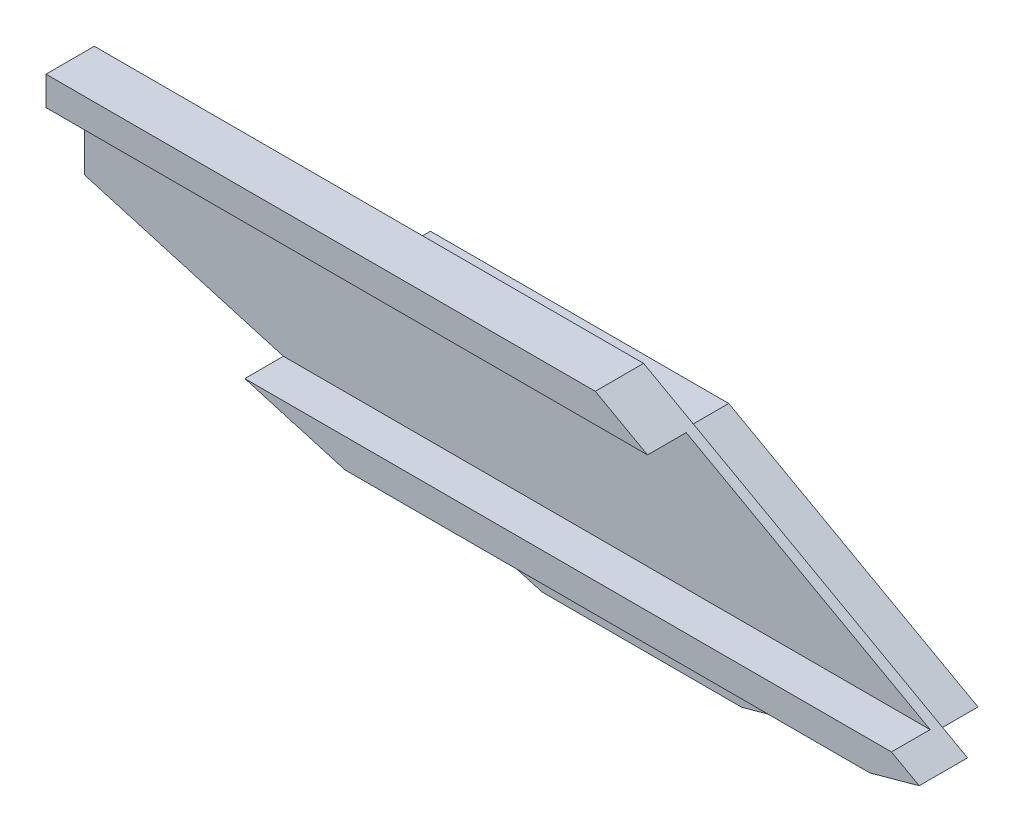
SolidWorks part; units mm, degrees
ref_plane "前视基准面" through (0, 0, 0) normal (0, 0, 1) x (1, 0, 0)
ref_plane "上视基准面" through (0, 0, 0) normal (0, 1, 0) x (1, 0, 0)
ref_plane "右视基准面" through (0, 0, 0) normal (1, 0, 0) x (0, 0, -1)
sketch "草图1" plane through (0, 0, 0) normal (0, 0, 1) x (1, 0, 0)
  line L1 (0, 0) -> (33, 0)
  line L2 (0, 0) -> (0, -10)
  line L3 (0, -10) -> (33, -10)
  line L4 (33, 0) -> (33, -10)
  dimension "D1" = 10
  dimension "D2" = 33
extrude "凸台-拉伸1" add sketch "草图1" along normal blind 0.5
sketch "草图2" plane through (0, 0, 0.5) normal (0, 0, 1) x (1, 0, 0)
  line L0 (-0.5, 0.5) -> (-0.5, -10.5)
  line L1 (-0.5, -10.5) -> (33.5, -10.5)
  line L2 (33.5, -10.5) -> (33.5, 0.5)
  line L3 (33.5, 0.5) -> (-0.5, 0.5)
  line L4 (0, 0) -> (0, -10)
  line L5 (0, -10) -> (33, -10)
  line L6 (33, -10) -> (33, 0)
  line L7 (33, 0) -> (0, 0)
  line L8 (0, 0) -> (0, -10)
  line L9 (0, -10) -> (33, -10)
  line L10 (33, -10) -> (33, 0)
  line L11 (33, 0) -> (0, 0)
  dimension "D1" = 0
  dimension "D2" = 0.5
extrude "凸台-拉伸2" add sketch "草图2" along normal blind 1 separate body
sketch "草图3" plane through (0, 0, 0.5) normal (0, 0, -1) x (-1, 0, 0)
  line L4 (0.5, 0.5) -> (-33.5, 0.5)
  line L5 (-33.5, 0.5) -> (-33.5, -10.5)
  line L6 (-33.5, -10.5) -> (0.5, -10.5)
  line L7 (0.5, -10.5) -> (0.5, 0.5)
  line L8 (0.5, 0.5) -> (-33.5, 0.5)
  line L9 (-33.5, 0.5) -> (-33.5, -10.5)
  line L10 (-33.5, -10.5) -> (0.5, -10.5)
  line L11 (0.5, -10.5) -> (0.5, 0.5)
  dimension "D1" = 0
extrude "凸台-拉伸3" add sketch "草图3" along normal up to vertex (0.5 mm away)
sketch "草图5" plane through (0, 0, 0) normal (0, 0, -1) x (-1, 0, 0)
  line L0 (-30.4036, 0.5) -> (-44.6915, -7.423)
  line L1 (-34.1336, -10.3686) -> (-29.3262, -8.9763)
  line L2 (-34.1336, -10.3686) -> (-29.3262, -8.9763)
  line L3 (-24.5283, -7.5868) -> (-19.7209, -6.1945)
  line L4 (-14.923, -4.805) -> (-10.1156, -3.4128)
  line L7 (-47.4457, -13.1749) -> (14.8709, 3.8235)
  line L8 (14.8709, 3.8235) -> (-26.6643, 2.5735)
  line L9 (-26.6643, 2.5735) -> (-30.4036, 0.5)
  line L10 (-30.4036, 0.5) -> (-13.3052, 0.5)
  line L11 (-13.3052, 0.5) -> (-44.6915, -7.423)
  line L12 (-44.6915, -7.423) -> (-53.6377, -12.3838)
  line L13 (-53.6377, -12.3838) -> (-47.4457, -13.1749)
  line L17 (-30.4036, 0.5) -> (-13.3052, 0.5)
  line L18 (-13.3052, 0.5) -> (-44.6915, -7.423)
  line L38 (-14.923, -4.805) -> (-19.7209, -6.1945)
  line L39 (-19.7209, -6.1945) -> (-14.6037, -6.1945)
  line L40 (-14.6037, -6.1945) -> (-19.411, -7.5868)
  line L41 (-19.411, -7.5868) -> (-24.5283, -7.5868)
  line L42 (-24.5283, -7.5868) -> (-29.3262, -8.9763)
  line L43 (-29.3262, -8.9763) -> (-24.209, -8.9763)
  line L44 (-24.209, -8.9763) -> (-29.0163, -10.3686)
  line L45 (-29.0163, -10.3686) -> (-34.1336, -10.3686)
  line L46 (-34.1336, -10.3686) -> (-40.3969, -12.1825)
  line L47 (-40.3969, -12.1825) -> (-30.038, -15.1825)
  line L48 (-30.038, -15.1825) -> (-20.1276, -15.1825)
  line L49 (-20.1276, -15.1825) -> (-8.8461, -9.538)
  line L50 (-8.8461, -9.538) -> (-8.8449, -9.5434)
  line L51 (-8.8449, -9.5434) -> (3.0947, -9.5434)
  line L52 (3.0947, -9.5434) -> (23.0511, -0.8309)
  line L53 (23.0511, -0.8309) -> (9.6613, -0.8992)
  line L54 (9.6613, -0.8992) -> (9.6881, -0.8685)
  line L55 (9.6881, -0.8685) -> (8.4073, -0.9056)
  line L56 (8.4073, -0.9056) -> (17.8593, 3.8235)
  line L57 (17.8593, 3.8235) -> (14.8709, 3.8235)
  line L58 (14.8709, 3.8235) -> (-10.1156, -3.4128)
  line L59 (-10.1156, -3.4128) -> (-4.9984, -3.4128)
  line L60 (-4.9984, -3.4128) -> (-9.8057, -4.805)
  line L61 (-9.8057, -4.805) -> (-14.923, -4.805)
  line L63 (-19.7209, -6.1945) -> (-14.6037, -6.1945)
  line L64 (-14.6037, -6.1945) -> (-19.411, -7.5868)
  line L65 (-19.411, -7.5868) -> (-24.5283, -7.5868)
  line L67 (-29.3262, -8.9763) -> (-24.209, -8.9763)
  line L68 (-24.209, -8.9763) -> (-29.0163, -10.3686)
  line L69 (-29.0163, -10.3686) -> (-34.1336, -10.3686)
  line L74 (-8.8461, -9.538) -> (-8.8449, -9.5434)
  line L83 (-10.1156, -3.4128) -> (-4.9984, -3.4128)
  line L84 (-4.9984, -3.4128) -> (-9.8057, -4.805)
  line L85 (-9.8057, -4.805) -> (-14.923, -4.805)
  dimension "D1" = 0
  dimension "D2" = 0
extrude "凸台-拉伸4" add sketch "草图5" along normal up to vertex (1.2754 mm away) contours L18 L0 M34 M35 | L18 L0 M35 | L69 L68 L67 L1 M35 | L65 L64 L63 L3 | L4 L83 L84 L85
sketch "草图6" plane through (0, 0, -1.2754) normal (0, 0, -1) x (-1, 0, 0)
  line L3 (-44.6915, -7.423) -> (-13.3052, 0.5)
  line L4 (-13.3052, 0.5) -> (-30.4036, 0.5)
  line L5 (-30.4036, 0.5) -> (-44.6915, -7.423)
  line L6 (-44.6915, -7.423) -> (-13.3052, 0.5)
  line L7 (-13.3052, 0.5) -> (-30.4036, 0.5)
  line L8 (-30.4036, 0.5) -> (-44.6915, -7.423)
  dimension "D1" = 0
extrude "凸台-拉伸5" add sketch "草图6" along normal up to vertex (0.7059 mm away)
sketch "草图7" plane through (0, 0, 0) normal (0, 0, 1) x (1, 0, 0)
  line L0 (33.5, -1.217) -> (44.6915, -7.423)
  line L1 (44.6915, -7.423) -> (33.5, -10.5)
  line L2 (33.5, -1.217) -> (33.5, -10.5)
extrude "凸台-拉伸6" add sketch "草图7" along normal up to vertex (0.5 mm away)
sketch "草图8" plane through (0, 0, 0.5) normal (0, 0, 1) x (1, 0, 0)
  line L1 (34, -9.844) -> (43.377, -7.2658)
  line L2 (43.377, -7.2658) -> (34, -2.066)
  line L3 (33.5, -1.217) -> (33.5, -10.5)
  line L4 (33.5, -10.5) -> (44.6915, -7.423)
  line L5 (44.6915, -7.423) -> (33.5, -1.217)
  line L7 (33.5, -10.5) -> (44.6915, -7.423)
  line L8 (44.6915, -7.423) -> (33.5, -1.217)
  line L9 (33.5, -1.217) -> (30.4036, 0.5)
  line L10 (33.5, -1.7788) -> (30.4036, 0)
  line L11 (33, 0) -> (0, 0) construction
  line L12 (30.4036, 0) -> (30.4036, 0.5)
  line L13 (33.5, -1.217) -> (33.5, -10.5) construction
  line L14 (33, -10) -> (33.5, -10)
  line L15 (33.5, -10) -> (34, -9.844)
  line L16 (34, -2.066) -> (33.5, -1.7788)
  line L17 (34, -2.066) -> (34, -9.844) construction
  line L18 (33, -10) -> (33, -10.5)
  line L19 (-0.5, -10.5) -> (33.5, -10.5) construction
  line L20 (33, -10.5) -> (33.5, -10.5)
  dimension "D1" = 0
  dimension "D2" = 0.5
extrude "凸台-拉伸7" add sketch "草图8" along normal up to vertex (1 mm away)
sketch "草图9" plane through (0, 0, 1.5) normal (0, 0, 1) x (1, 0, 0)
  line L4 (33, -0.9398) -> (31.3053, 0) construction
  line L5 (33, -0.9398) -> (31.3053, 0)
  line L6 (33.5, 0.5) -> (-0.5, 0.5)
  line L7 (-0.5, 0.5) -> (-0.5, -10.5)
  line L8 (-0.5, -10.5) -> (33.5, -10.5)
  line L9 (33.5, -10.5) -> (44.6915, -7.423)
  line L10 (44.6915, -7.423) -> (33.5, -1.217)
  line L11 (33.5, -1.217) -> (33.5, 0.5)
  line L12 (33.5, 0.5) -> (30.4036, 0.5)
  line L18 (33, -0.9398) -> (33.5, -1.217)
  line L19 (33.5, -1.217) -> (33.5, 0.5)
  line L20 (31.3167, -0.0063) -> (30.4036, 0.5)
  dimension "D1" = 0
extrude "切除-拉伸2" cut sketch "草图9" against normal through all contours L20 L18 M27 M28 M25 M20 | L5 M26 M28 M27
sketch "草图10" plane through (0, 0, 1.5) normal (0, 0, 1) x (1, 0, 0)
  line L0 (33, -10) -> (33, -1.4915) construction
  line L1 (33.5, -10) -> (33.5, -1.7788) construction
  line L2 (33, -10) -> (33, -1.4915)
  line L3 (33.5, -10) -> (33.5, -1.7788)
  line L4 (33.5, -1.7788) -> (33, -1.4915)
  line L5 (33.5, -10) -> (33, -10)
extrude "切除-拉伸3" cut sketch "草图10" against normal up to vertex (1 mm away)
sketch "草图11" plane through (0, 0, 0) normal (0, 0, -1) x (-1, 0, 0)
  line L0 (-23.1646, -10.5) -> (0.5, -3.6465)
  line L1 (-33.5, -10.5) -> (0.5, -10.5) construction
  line L2 (0.5, -10.5) -> (0.5, 0.5) construction
  line L3 (-14.6037, -6.1945) -> (-19.411, -7.5868) construction
  line L4 (0.5, -3.6465) -> (0.5, -10.5)
  line L5 (0.5, -10.5) -> (-23.1646, -10.5)
extrude "切除-拉伸4" cut sketch "草图11" against normal through all
sketch "草图12" plane through (0, 0, 0.5) normal (0, 0, 1) x (1, 0, 0)
  line L2 (33.5, -10) -> (33.6278, -10.4649)
  line L9 (33.5, -10.5) -> (44.6915, -7.423) construction
  line L39 (33.5, -10) -> (33.566, -9.7374)
  line L40 (33.566, -9.7374) -> (43.2368, -7.2658)
  line L41 (43.2368, -7.2658) -> (43.377, -7.2658)
  line L43 (43.377, -7.2658) -> (43.5096, -7.7479)
  line L44 (33.6278, -10.4649) -> (43.5096, -7.7479)
extrude "切除-拉伸5" cut sketch "草图12" along normal up to vertex (1 mm away)
sketch "草图13" plane through (0, 0, 1.5) normal (0, 0, 1) x (1, 0, 0)
  line L5 (33.5, -10.5) -> (33.6278, -10.4649)
  line L6 (33.6278, -10.4649) -> (33.5, -10)
  line L7 (33.5, -10) -> (21.4381, -10)
  line L8 (21.4381, -10) -> (23.1646, -10.5)
  line L9 (23.1646, -10.5) -> (33.5, -10.5)
  line L10 (33.5, -10.5) -> (33.6278, -10.4649)
  line L11 (33.6278, -10.4649) -> (33.5, -10)
  line L12 (33.5, -10) -> (21.4381, -10)
  line L13 (21.4381, -10) -> (23.1646, -10.5)
  line L14 (23.1646, -10.5) -> (33.5, -10.5)
  line L20 (34, -2.066) -> (43.377, -7.2658)
  line L21 (43.377, -7.2658) -> (43.5096, -7.7479)
  line L22 (43.5096, -7.7479) -> (44.6915, -7.423)
  line L23 (44.6915, -7.423) -> (30.4036, 0.5)
  line L24 (30.4036, 0.5) -> (-0.5, 0.5)
  line L25 (-0.5, 0.5) -> (-0.5, -3.6465)
  line L26 (-0.5, -3.6465) -> (0, -3.7913)
  line L27 (0, -3.7913) -> (0, 0)
  line L28 (0, 0) -> (30.4036, 0)
  line L29 (30.4036, 0) -> (34, -2.066)
  line L30 (34, -2.066) -> (43.377, -7.2658)
  line L31 (43.377, -7.2658) -> (43.5096, -7.7479)
  line L32 (43.5096, -7.7479) -> (44.6915, -7.423)
  line L33 (44.6915, -7.423) -> (30.4036, 0.5)
  line L34 (30.4036, 0.5) -> (-0.5, 0.5)
  line L35 (-0.5, 0.5) -> (-0.5, -3.6465)
  line L36 (-0.5, -3.6465) -> (0, -3.7913)
  line L37 (0, -3.7913) -> (0, 0)
  line L38 (0, 0) -> (30.4036, 0)
  line L39 (30.4036, 0) -> (34, -2.066)
  dimension "D1" = 0
  dimension "D2" = 0
extrude "切除-拉伸7" cut sketch "草图13" against normal up to vertex (1 mm away)
sketch "草图15" plane through (0, 0, 0.5) normal (0, 0, 1) x (1, 0, 0)
  line L0 (-0.5, 0.5) -> (-0.5, -3.6465) construction
  line L1 (-0.5, -0.626) -> (32.4342, -0.626)
  line L3 (6.3351, -5.626) -> (39.0695, -5.626)
  line L5 (-0.5, -0.626) -> (-0.5, 1.874)
  line L6 (-0.5, 4.8235) -> (-0.5, -2.1765) construction
  line L8 (-0.5, 1.874) -> (27.9259, 1.874)
  line L9 (34.889, -1.9873) -> (22.6068, 4.8235) construction
  line L10 (27.9259, 1.874) -> (32.4342, -0.626)
  line L11 (44.6915, -7.423) -> (30.4036, 0.5) construction
  line L12 (14.9674, -8.126) -> (42.1343, -8.126)
  line L13 (6.3351, -5.626) -> (14.9674, -8.126)
  line L14 (-0.5, -3.6465) -> (23.1646, -10.5) construction
  line L15 (39.0695, -5.626) -> (41.451, -5.626)
  line L16 (41.451, -5.626) -> (44.6915, -7.423)
  line L17 (44.6915, -7.423) -> (42.1343, -8.126)
  line L18 (33.5, -10.5) -> (44.6915, -7.423) construction
  dimension "D2" = 2.5
extrude "凸台-拉伸8" add sketch "草图15" along normal blind 2
sketch "草图16" plane through (0, 0, 0.5) normal (0, 0, -1) x (-1, 0, 0)
  line L4 (-27.9259, 1.874) -> (-30.4036, 0.5)
  line L5 (-30.4036, 0.5) -> (0.5, 0.5)
  line L6 (0.5, 0.5) -> (0.5, 1.874)
  line L7 (0.5, 1.874) -> (-27.9259, 1.874)
  line L8 (-27.9259, 1.874) -> (-30.4036, 0.5)
  line L9 (-30.4036, 0.5) -> (0.5, 0.5)
  line L10 (0.5, 0.5) -> (0.5, 1.874)
  line L11 (0.5, 1.874) -> (-27.9259, 1.874)
  dimension "D1" = 0
extrude "凸台-拉伸9" add sketch "草图16" along normal up to vertex
sketch "草图17" plane through (0, 0, -1.9813) normal (0, 0, -1) x (-1, 0, 0)
  line L0 (-14.923, -4.805) -> (-9.8057, -4.805) construction
  line L1 (-9.8057, -4.805) -> (-4.9984, -3.4128) construction
  line L2 (-4.9984, -3.4128) -> (-10.1156, -3.4128) construction
  line L3 (-10.1156, -3.4128) -> (-14.923, -4.805) construction
  line L4 (-24.5283, -7.5868) -> (-19.411, -7.5868) construction
  line L5 (-19.411, -7.5868) -> (-14.6037, -6.1945) construction
  line L6 (-14.6037, -6.1945) -> (-19.7209, -6.1945) construction
  line L7 (-19.7209, -6.1945) -> (-24.5283, -7.5868) construction
  line L8 (-33.5, -10.3686) -> (-29.0163, -10.3686) construction
  line L9 (-29.0163, -10.3686) -> (-24.209, -8.9763) construction
  line L10 (-24.209, -8.9763) -> (-29.3262, -8.9763) construction
  line L11 (-29.3262, -8.9763) -> (-33.5, -10.1851) construction
  line L12 (-33.5, -10.1851) -> (-33.5, -10.3686) construction
  line L13 (-30.4036, 0.5) -> (-44.6915, -7.423) construction
  line L14 (-44.6915, -7.423) -> (-13.3052, 0.5) construction
  line L15 (-13.3052, 0.5) -> (-30.4036, 0.5) construction
  line L16 (-14.923, -4.805) -> (-9.8057, -4.805)
  line L17 (-9.8057, -4.805) -> (-4.9984, -3.4128)
  line L18 (-4.9984, -3.4128) -> (-10.1156, -3.4128)
  line L19 (-10.1156, -3.4128) -> (-14.923, -4.805)
  line L20 (-24.5283, -7.5868) -> (-19.411, -7.5868)
  line L21 (-19.411, -7.5868) -> (-14.6037, -6.1945)
  line L22 (-14.6037, -6.1945) -> (-19.7209, -6.1945)
  line L23 (-19.7209, -6.1945) -> (-24.5283, -7.5868)
  line L24 (-33.5, -10.3686) -> (-29.0163, -10.3686)
  line L25 (-29.0163, -10.3686) -> (-24.209, -8.9763)
  line L26 (-24.209, -8.9763) -> (-29.3262, -8.9763)
  line L27 (-29.3262, -8.9763) -> (-33.5, -10.1851)
  line L28 (-33.5, -10.1851) -> (-33.5, -10.3686)
  line L29 (-30.4036, 0.5) -> (-44.6915, -7.423)
  line L30 (-44.6915, -7.423) -> (-13.3052, 0.5)
  line L31 (-13.3052, 0.5) -> (-30.4036, 0.5)
  line L32 (-13.5134, -4.605) -> (-9.8341, -4.605)
  line L33 (-9.8341, -4.605) -> (-6.4079, -3.6128)
  line L34 (-6.4079, -3.6128) -> (-10.0873, -3.6128)
  line L35 (-10.0873, -3.6128) -> (-13.5134, -4.605)
  line L36 (-23.1187, -7.3868) -> (-19.4394, -7.3868)
  line L37 (-19.4394, -7.3868) -> (-16.0132, -6.3945)
  line L38 (-16.0132, -6.3945) -> (-19.6926, -6.3945)
  line L39 (-19.6926, -6.3945) -> (-23.1187, -7.3868)
  line L40 (-32.724, -10.1686) -> (-29.0447, -10.1686)
  line L41 (-29.0447, -10.1686) -> (-25.6185, -9.1763)
  line L42 (-25.6185, -9.1763) -> (-29.2979, -9.1763)
  line L43 (-29.2979, -9.1763) -> (-32.724, -10.1686)
  line L44 (-32.724, -10.1686) -> (-32.724, -10.1686)
  line L45 (-30.3519, 0.3) -> (-43.2516, -6.8532)
  line L46 (-43.2516, -6.8532) -> (-14.9147, 0.3)
  line L47 (-14.9147, 0.3) -> (-30.3519, 0.3)
  dimension "D1" = 0.2
extrude "切除-拉伸8" cut sketch "草图17" against normal up to vertex
sketch "草图18" plane through (0, 0, 0.5) normal (0, 0, 1) x (1, 0, 0)
  line L0 (-0.5, 0.374) -> (24.7373, 0.374)
  line L1 (24.7373, 0.374) -> (30.6309, 0.374)
  line L2 (9.788, -6.626) -> (43.2543, -6.626)
  line L4 (-0.5, 1.874) -> (-0.5, -0.626)
  line L5 (-0.5, -0.626) -> (32.4342, -0.626)
  line L6 (32.4342, -0.626) -> (27.9259, 1.874)
  line L7 (27.9259, 1.874) -> (-0.5, 1.874)
  line L8 (-0.5, 0.374) -> (-0.5, -0.626)
  line L9 (-0.5, -0.626) -> (32.4342, -0.626)
  line L10 (32.4342, -0.626) -> (30.6309, 0.374)
  line L13 (41.451, -5.626) -> (6.3351, -5.626)
  line L14 (6.3351, -5.626) -> (14.9674, -8.126)
  line L15 (14.9674, -8.126) -> (42.1343, -8.126)
  line L16 (42.1343, -8.126) -> (44.6915, -7.423)
  line L17 (44.6915, -7.423) -> (41.451, -5.626)
  line L18 (41.451, -5.626) -> (6.3351, -5.626)
  line L19 (6.3351, -5.626) -> (9.788, -6.626)
  line L22 (43.2543, -6.626) -> (41.451, -5.626)
  dimension "D3" = 1
  dimension "D4" = 1
  dimension "D1" = 0
  dimension "D2" = 0
extrude "切除-拉伸9" cut sketch "草图18" along normal through all
